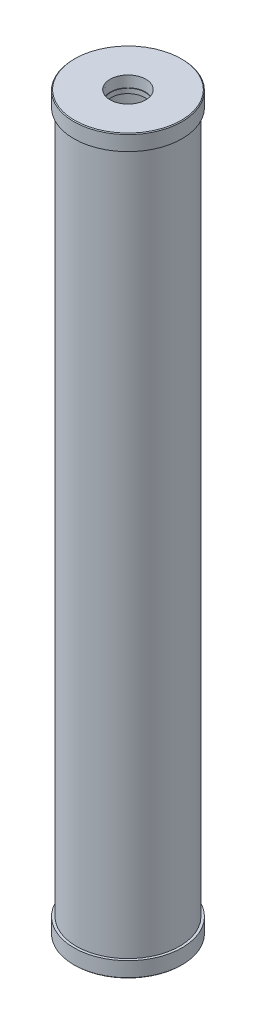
SolidWorks part; units mm, degrees
ref_plane "Front Plane" through (0, 0, 0) normal (0, 0, 1) x (1, 0, 0)
ref_plane "Top Plane" through (0, 0, 0) normal (0, 1, 0) x (1, 0, 0)
ref_plane "Right Plane" through (0, 0, 0) normal (1, 0, 0) x (0, 0, -1)
sketch "Sketch1" plane through (0, 0, 0) normal (0, 1, 0) x (1, 0, 0)
  circle A0 centre (0, 0) radius 84.201
  circle A1 centre (0, 0) radius 74.676
  dimension "D1" = 168.402
  dimension "D2" = 9.525
extrude "Boss-Extrude1" add sketch "Sketch1" along normal blind 1193.8
ref_plane "Plane1" through (0, 1193.8, 0) normal (0, 1, 0) x (1, 0, 0)
sketch "Sketch2" plane through (0, 0, 0) normal (0, 1, 0) x (1, 0, 0)
  circle A0 centre (0, 0) radius 88.265
  dimension "D1" = 176.53
extrude "Boss-Extrude2" add sketch "Sketch2" along normal blind 25.4
sketch "Sketch3" plane through (0, 1193.8, 0) normal (0, 1, 0) x (1, 0, 0)
  circle A0 centre (0, 0) radius 88.265
  dimension "D1" = 176.53
extrude "Boss-Extrude3" add sketch "Sketch3" against normal blind 25.4
hole_wizard "2 NPT Tapped Hole1" positions "Sketch5" profile "Sketch4" size "2" standard "ANSI Inch"
sketch "Sketch5" plane through (0, 1193.8, 0) normal (0, 1, 0) x (1, 0, 0)
  point P0 (0, 0)
sketch "Sketch4" plane through (0, 1193.8, 0) normal (1, 0, 0) x (0, 0, 1)
  line L0 (0, 0) -> (0, 45.6525)
  line L1 (27.7876, 28.956) -> (0, 45.6525)
  line L2 (-27.7876, 28.956) -> (0, 45.6525) construction
  line L3 (27.7876, 28.956) -> (27.7876, 17.78)
  line L4 (27.7876, 17.78) -> (28.6326, 17.78)
  line L5 (28.6326, 17.78) -> (29.165, 0)
  line L6 (-28.6326, 17.78) -> (-29.165, 0) construction
  line L7 (29.165, 0) -> (0, 0)
  line L8 (0, -6.35) -> (0, 107.95) construction
  line L11 (-27.7876, 17.78) -> (-28.6326, 17.78) construction
  dimension "Tap Drill Dia." = 55.5752
  dimension "Tap Drill Depth" = 28.956
  dimension "Thread Dia." = 58.33
  dimension "Thread Angle" = 3.43
  dimension "Thread Depth" = 17.78
  dimension "Drill Angle" = 118
hole_wizard "2 NPT Tapped Hole3" positions "Sketch11" profile "Sketch10" size "2" standard "ANSI Inch"
sketch "Sketch11" plane through (0, 0, 0) normal (0, 1, 0) x (1, 0, 0)
  point P0 (0, 0)
sketch "Sketch10" plane through (0, 0, 0) normal (1, 0, 0) x (0, 0, -1)
  line L0 (0, 0) -> (0, 45.6525)
  line L1 (27.7876, 28.956) -> (0, 45.6525)
  line L2 (-27.7876, 28.956) -> (0, 45.6525) construction
  line L3 (27.7876, 28.956) -> (27.7876, 17.78)
  line L4 (27.7876, 17.78) -> (28.6326, 17.78)
  line L5 (28.6326, 17.78) -> (29.165, 0)
  line L6 (-28.6326, 17.78) -> (-29.165, 0) construction
  line L7 (29.165, 0) -> (0, 0)
  line L8 (0, -6.35) -> (0, 107.95) construction
  line L11 (-27.7876, 17.78) -> (-28.6326, 17.78) construction
  dimension "Tap Drill Dia." = 55.5752
  dimension "Tap Drill Depth" = 28.956
  dimension "Thread Dia." = 58.33
  dimension "Thread Angle" = 3.43
  dimension "Thread Depth" = 17.78
  dimension "Drill Angle" = 118
chamfer "Chamfer1" distance 1.27 angle 45 2 edges at (0, 0, 88.265) (0, 1193.8, 88.265)
